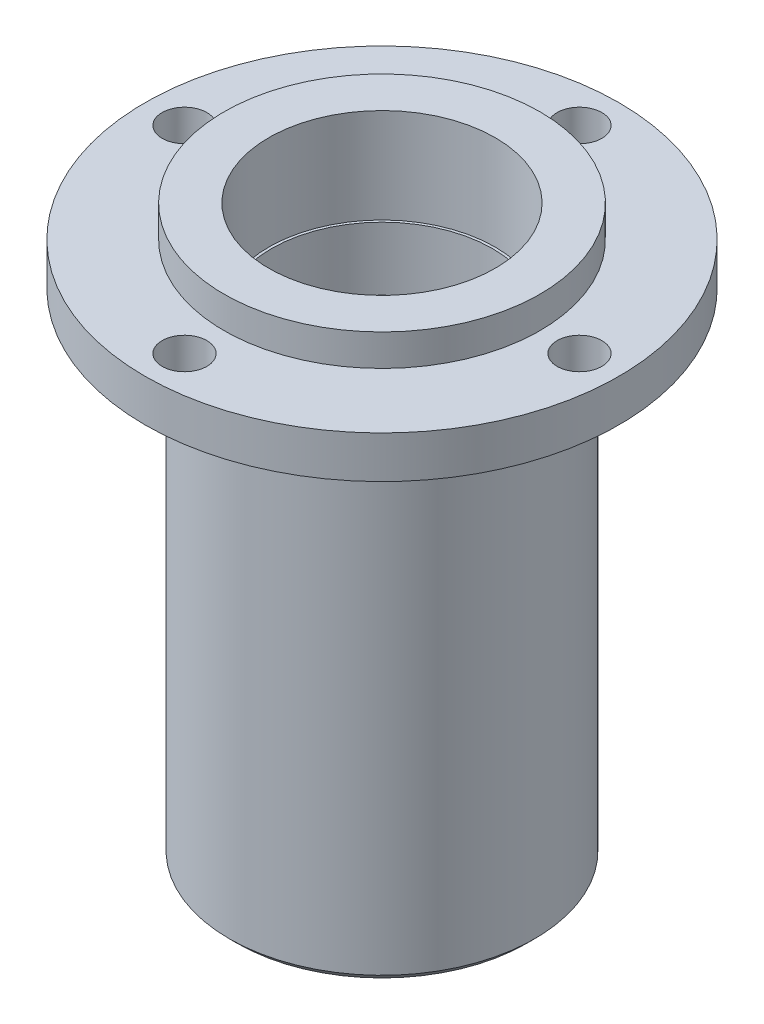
SolidWorks part; units mm, degrees
ref_plane "Plan1" through (0, 0, 0) normal (0, 0, 1) x (1, 0, 0)
ref_plane "Plan2" through (0, 0, 0) normal (0, 1, 0) x (1, 0, 0)
ref_plane "Plan3" through (0, 0, 0) normal (1, 0, 0) x (0, 0, -1)
sketch "Esquisse3" plane through (0, 0, 0) normal (0, 0, 1) x (1, 0, 0)
  line L0 (0, 0) -> (0, 53.8317) construction
  line L1 (21, 0) -> (29, 0)
  line L2 (29, 0) -> (29, 94)
  line L3 (29, 94) -> (45, 94)
  line L4 (45, 94) -> (45, 102)
  line L5 (45, 102) -> (30, 102)
  line L6 (30, 102) -> (30, 108)
  line L7 (30, 108) -> (21.5, 108)
  line L8 (21.5, 108) -> (21.5, 90)
  line L9 (21.5, 90) -> (21, 90)
  line L10 (21, 90) -> (21, 78)
  line L11 (21, 78) -> (19, 78)
  line L12 (19, 78) -> (19, 12)
  line L13 (19, 12) -> (21, 12)
  line L14 (21, 12) -> (21, 0)
  dimension "D1" = 19
  dimension "D2" = 45
  dimension "D3" = 30
  dimension "D4" = 21.5
  dimension "D5" = 21
  dimension "D6" = 6
  dimension "D7" = 14
  dimension "D8" = 108
  dimension "D9" = 29
  dimension "D10" = 24
  dimension "D11" = 12
  dimension "D12" = 66
revolve "Base-Révolution" add sketch "Esquisse3" angle 360 about L0
other "Perçage1"
sketch "Esquisse4" plane through (0, 102, 0) normal (0, 1, 0) x (-1, 0, 0)
  line L0 (0, 0) -> (0, -45.7695) construction
  circle A0 centre (0, -37.5) radius 4.25
  dimension "D1" = 8.5
  dimension "D2" = 37.5
pattern_circular "Répétition circulaire1" count 4 every 90 about axis through (0, 0, 0) along (0, 1, 0)
chamfer "Chanfrein1" distance 1.5 angle 45
